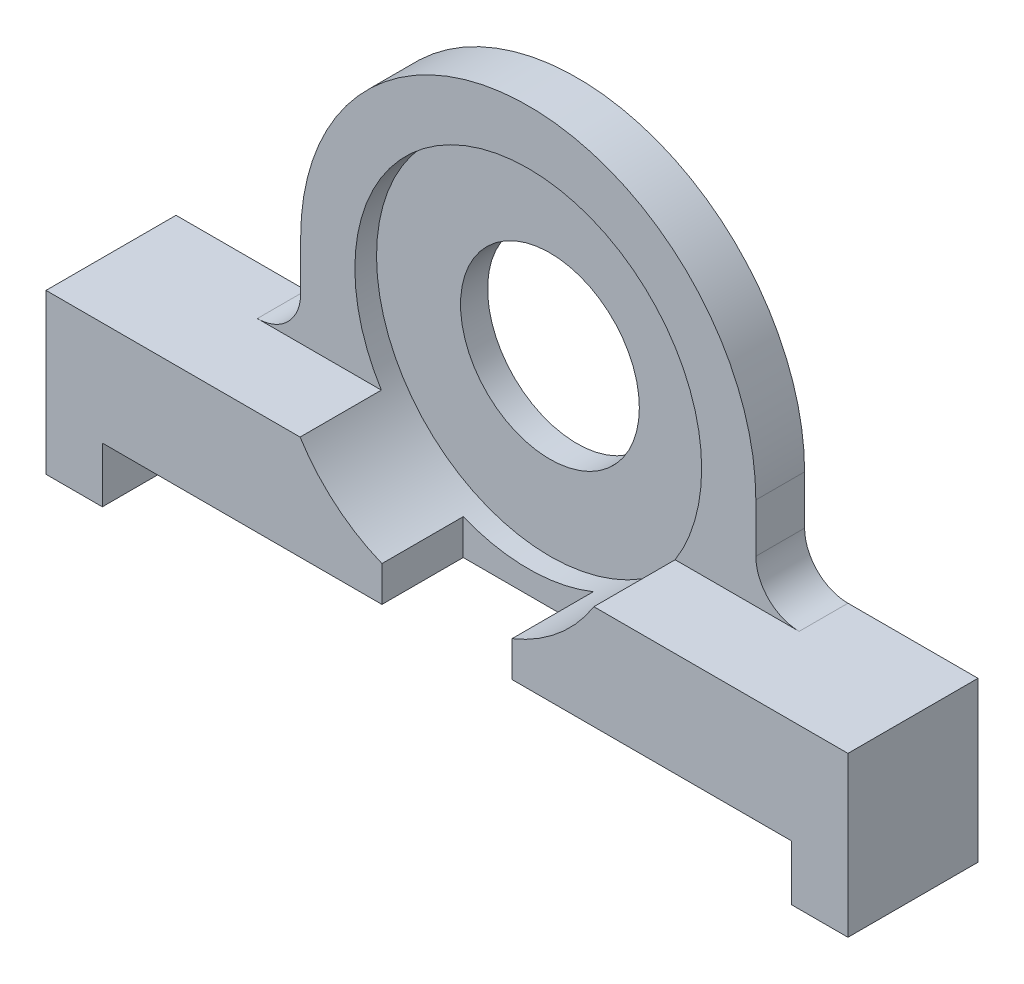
SolidWorks part; units mm, degrees
ref_plane "Front Plane" through (0, 0, 0) normal (0, 0, 1) x (1, 0, 0)
ref_plane "Top Plane" through (0, 0, 0) normal (0, 1, 0) x (1, 0, 0)
ref_plane "Right Plane" through (0, 0, 0) normal (1, 0, 0) x (0, 0, -1)
sketch "Sketch2" plane through (0, 0, 0) normal (0, 0, 1) x (1, 0, 0)
  line L0 (-21, 0) -> (21, 0)
  line L1 (-21, 14.7) -> (-21, 23.2)
  line L2 (21, 23.2) -> (21, 14.7)
  line L3 (21, 14.7) -> (37, 14.7)
  line L4 (37, 14.7) -> (37, 0)
  line L9 (37, 0) -> (21, 0)
  line L10 (0, 9.4378) -> (0, -16.7527) construction
  line L11 (-37, 0) -> (-21, 0)
  line L12 (-37, 14.7) -> (-37, 0)
  line L13 (-21, 14.7) -> (-37, 14.7)
  circle A1 centre (0, 23.2) radius 16
  arc A3 (-21, 23.2) -> (21, 23.2) centre (0, 23.2) cw
  point P2 (0, 44.2)
  point P7 (0, 0)
  point P8 (0, 0.9)
  point P10 (0, 7.2)
  point P12 (0, 39.2)
  dimension "D1" = 32
  dimension "D6" = 23.2
  dimension "D2" = 14.7
  dimension "D3" = 16
  dimension "D5" = 5
extrude "Boss-Extrude1" add sketch "Sketch2" along normal blind 12
sketch "Sketch3" plane through (0, 0, 0) normal (0, 0, 1) x (1, 0, 0)
  circle A1 centre (0, 23.2) radius 8.25
  circle A2 centre (0, 23.2) radius 16 construction
  circle A3 centre (0, 23.2) radius 16
  dimension "D1" = 16.5
extrude "Boss-Extrude2" add sketch "Sketch3" along normal blind 2.5
sketch "Sketch8" plane through (0, 0, 0) normal (0, 0, 1) x (1, 0, 0)
  line L0 (-37, 0) -> (37, 0) construction
  line L1 (-27, 0) -> (27, 0)
  line L2 (-27, 0) -> (-27, 10.7)
  line L3 (-27, 10.7) -> (27, 10.7)
  line L4 (27, 0) -> (27, 10.7)
  point P6 (0, 10.7)
  dimension "D1" = 54
  dimension "D2" = 10.7
extrude "Cut-Extrude4" cut sketch "Sketch8" along normal blind 1
sketch "Sketch9" plane through (0, 0, 1) normal (0, 0, -1) x (-1, 0, 0)
  line L0 (27, 0) -> (-27, 0) construction
  line L1 (21.8, 0) -> (-21.8, 0)
  line L2 (21.8, 0) -> (21.8, 5.1)
  line L3 (21.8, 5.1) -> (-21.8, 5.1)
  line L4 (-21.8, 0) -> (-21.8, 5.1)
  line L5 (-27, 0) -> (-27, 10.7) construction
  point P6 (0, 5.1)
  dimension "D1" = 5.2
  dimension "D2" = 5.1
extrude "Cut-Extrude5" cut sketch "Sketch9" against normal up to next
sketch "Sketch10" plane through (0, 0, 0) normal (0, -1, 0) x (1, 0, 0)
  line L0 (-37, 12) -> (-21.8, 12) construction
  line L1 (-37, 12) -> (-37, 0) construction
  line L2 (0, 0) -> (0, 15.6223) construction
  line L3 (-37, 0) -> (-27, 0) construction
  circle A0 centre (-34, 9) radius 1.25
  circle A1 centre (-34, 3) radius 1.25
  circle A2 centre (34, 3) radius 1.25
  circle A3 centre (34, 9) radius 1.25
  dimension "D1" = 2.5
  dimension "D4" = 3
  dimension "D2" = 3
  dimension "D3" = 3
extrude "Cut-Extrude6" cut sketch "Sketch10" against normal blind 9
sketch "Sketch11" plane through (0, 0, 12) normal (0, 0, 1) x (1, 0, 0)
  line L0 (21, 14.7) -> (21, 23.2) construction
  line L1 (-21, 23.2) -> (-21, 14.7) construction
  line L2 (21, 14.7) -> (21, 23.2)
  line L3 (-21, 23.2) -> (-21, 14.7)
  line L4 (-21, 14.7) -> (21, 14.7)
  arc A0 (21, 23.2) -> (-21, 23.2) centre (0, 23.2) ccw construction
  arc A1 (21, 23.2) -> (-21, 23.2) centre (0, 23.2) ccw
extrude "Cut-Extrude7" cut sketch "Sketch11" against normal offset from surface (7.5 mm away) 2
fillet "Filete1" radius 2 2 edges at (27, 10.7, 0.5) (-27, 10.7, 0.5)
fillet "Filete2" radius 4 2 edges at (-21, 14.7, 2.25) (21, 14.7, 2.25)
sketch "Sketch12" plane through (0, 0, 12) normal (0, 0, 1) x (1, 0, 0)
  line L0 (21.8, 5.1) -> (-21.8, 5.1) construction
  line L1 (21.8, 0) -> (31.8, 0)
  line L2 (21.8, 0) -> (21.8, 5.1)
  line L3 (21.8, 5.1) -> (31.8, 5.1)
  line L4 (31.8, 0) -> (31.8, 5.1)
  line L5 (0, 0) -> (0, 5.354) construction
  line L6 (-31.8, 0) -> (-31.8, 5.1)
  line L7 (-21.8, 5.1) -> (-31.8, 5.1)
  line L8 (-21.8, 0) -> (-21.8, 5.1)
  line L9 (-21.8, 0) -> (-31.8, 0)
  dimension "D1" = 10
extrude "Cut-Extrude8" cut sketch "Sketch12" against normal blind 7
sketch "Sketch14" plane through (0, 0, 5) normal (0, 0, 1) x (1, 0, 0)
  line L1 (24.8, 1.05) -> (31.8, 1.05)
  line L2 (24.8, 1.05) -> (24.8, 4.05)
  line L3 (24.8, 4.05) -> (31.8, 4.05)
  line L4 (31.8, 1.05) -> (31.8, 4.05)
  line L5 (31.8, 0) -> (31.8, 5.1) construction
  line L6 (31.8, 0) -> (31.8, 5.1) construction
  line L7 (0, 0) -> (0, 5.8267) construction
  line L8 (-31.8, 1.05) -> (-31.8, 4.05)
  line L9 (-24.8, 4.05) -> (-31.8, 4.05)
  line L10 (-24.8, 1.05) -> (-24.8, 4.05)
  line L11 (-24.8, 1.05) -> (-31.8, 1.05)
  point P8 (31.8, 2.55)
  point P9 (-31.8, 2.55)
  dimension "D1" = 3
  dimension "D2" = 7
extrude "Cut-Extrude9" [suppressed] cut sketch "Sketch14" against normal blind 1.5
fillet "Fillet1" [suppressed] radius 1.5
sketch "Sketch15" plane through (0, 0, 12) normal (0, 0, 1) x (1, 0, 0)
  line L0 (31.8, 5.1) -> (-31.8, 5.1) construction
  line L1 (-6, 5.1) -> (6, 5.1)
  line L2 (-6, 5.1) -> (-6, 8.3676)
  line L3 (-6, 8.3676) -> (6, 8.3676)
  line L4 (6, 5.1) -> (6, 8.3676)
  arc A0 (-13.5554, 14.7) -> (13.5554, 14.7) centre (0, 23.2) ccw construction
  point P6 (0, 8.3676)
  point P8 (0, 0)
  dimension "D1" = 12
extrude "Cut-Extrude10" cut sketch "Sketch15" against normal up to surface (7.5 mm away)
